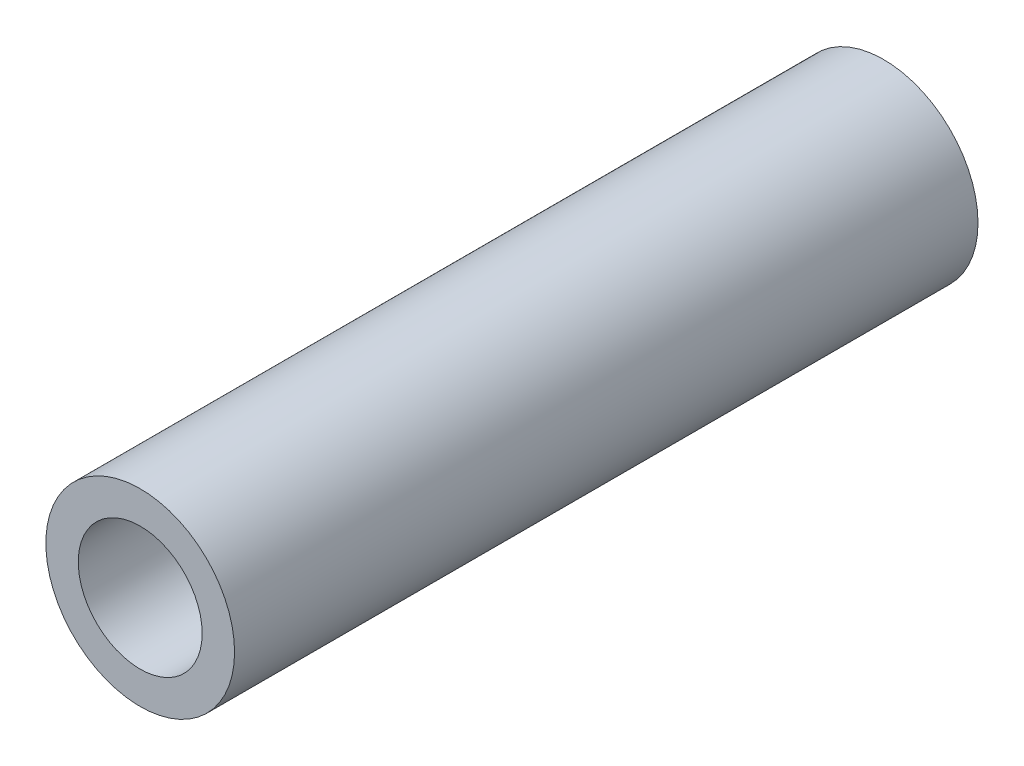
SolidWorks part; units mm, degrees
ref_plane "Plan de face" through (0, 0, 0) normal (0, 0, 1) x (1, 0, 0)
ref_plane "Plan de dessus" through (0, 0, 0) normal (0, 1, 0) x (1, 0, 0)
ref_plane "Plan de droite" through (0, 0, 0) normal (1, 0, 0) x (0, 0, -1)
sketch "Esquisse1" plane through (0, 0, 0) normal (0, 0, 1) x (1, 0, 0)
  circle A0 centre (0, 0) radius 3.25
  circle A1 centre (0, 0) radius 4.95
  dimension "D1" = 6.5
  dimension "D2" = 9.9
  dimension "D3" = 1.7
extrude "Boss.-Extru.1" add sketch "Esquisse1" along normal blind 39
